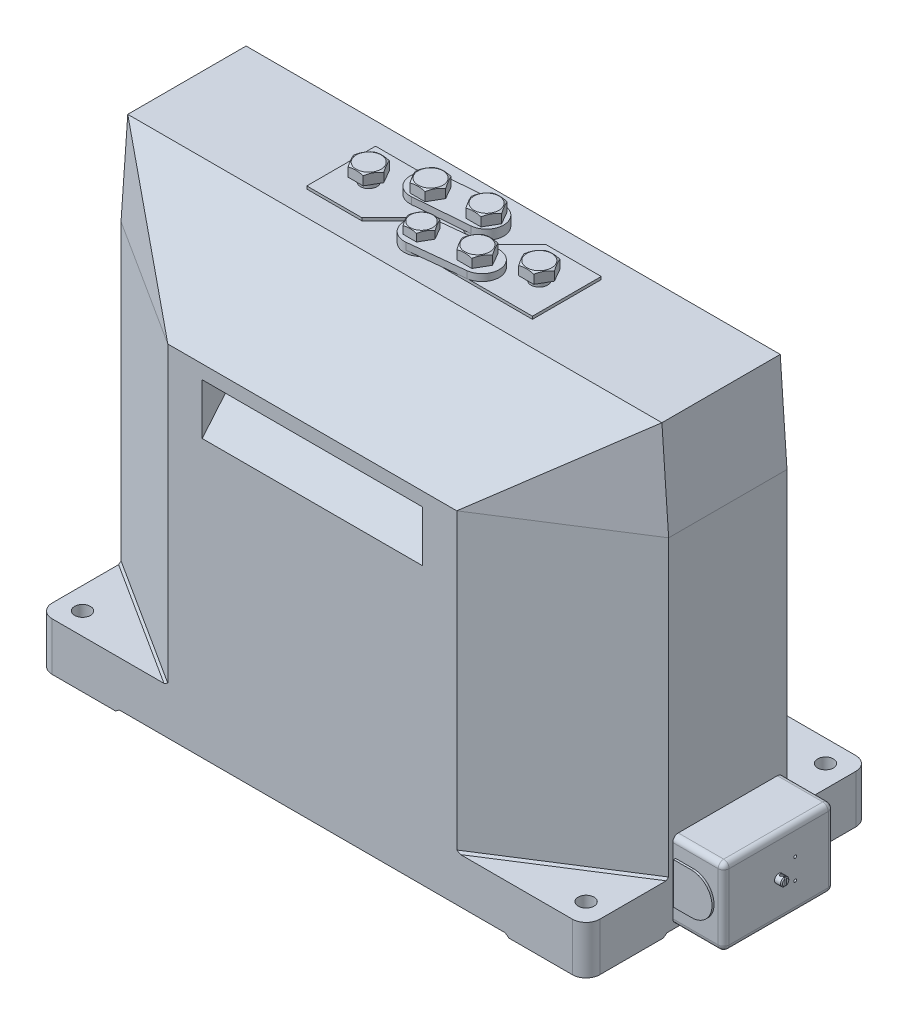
SolidWorks part; units mm, degrees
ref_plane "Front Plane" through (0, 0, 0) normal (0, 0, 1) x (1, 0, 0)
ref_plane "Top Plane" through (0, 0, 0) normal (0, 1, 0) x (1, 0, 0)
ref_plane "Right Plane" through (0, 0, 0) normal (1, 0, 0) x (0, 0, -1)
other "Join1"
other "HlTmCsDIN933<6>@24305_AM-40b_Körvonalrajzhoz"
other "HlTmCsDIN933<4>@24305_AM-40b_Körvonalrajzhoz"
other "HlTmCsDIN933<5>@24305_AM-40b_Körvonalrajzhoz"
other "HlTmCsDIN933<7>@24305_AM-40b_Körvonalrajzhoz"
other "HlTmCsDIN933<3>@24305_AM-40b_Körvonalrajzhoz"
other "HlTmCsDIN933<2>@24305_AM-40b_Körvonalrajzhoz"
other "24205-124_ÁtkötőLamella<2>@24305_AM-40b_Körvonalrajzhoz"
other "24205-124_ÁtkötőLamella<1>@24305_AM-40b_Körvonalrajzhoz"
other "HlTmCsDIN933<1>@24305_AM-40b_Körvonalrajzhoz"
other "21105-115_PlombaCsavar<1>@24305_AM-40b_Körvonalrajzhoz"
other "FME12_Tömszelence_29519_112<1>@24305_AM-40b_Körvonalrajzhoz"
other "AM40b_TRA_Kiöntött_Körvonalrajzhoz<1>@24305_AM-40b_Körvonalrajzhoz/AM40b_TRA_Test_T24305<1>@AM40b_TRA_Kiöntött_Körvonalrajzhoz"
other "FME12_Tömszelence_29519_112<2>@24305_AM-40b_Körvonalrajzhoz"
other "FME12_TRA_Kapocsfedél_29519_113<1>@24305_AM-40b_Körvonalrajzhoz"
